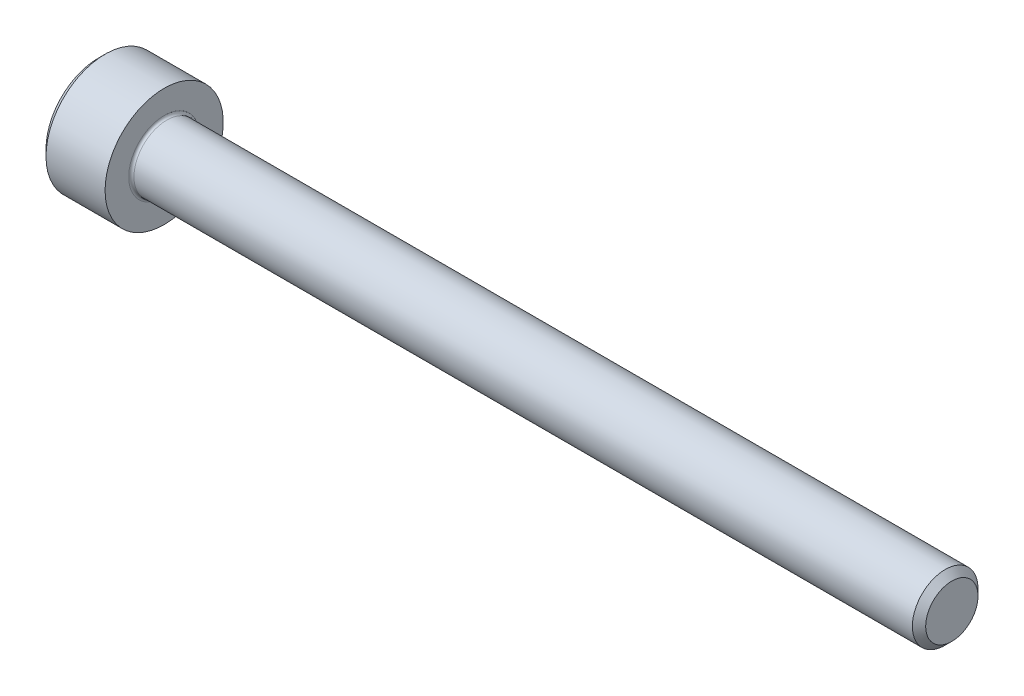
SolidWorks part; units mm, degrees
ref_plane "Plane1" through (0, 0, 0) normal (0, 0, 1) x (1, 0, 0)
ref_plane "Plane2" through (0, 0, 0) normal (0, 1, 0) x (1, 0, 0)
ref_plane "Plane3" through (0, 0, 0) normal (1, 0, 0) x (0, 0, -1)
sketch "BodySke" plane through (0, 0, 0) normal (0, 0, 1) x (1, 0, 0)
  line L0 (0, 0) -> (0, 2)
  line L1 (0.25, 2.25) -> (2.5, 2.25)
  line L2 (2.5, 2.25) -> (2.5, 1.25)
  line L3 (2.5, 1.25) -> (32.2465, 1.25)
  line L4 (32.5, 0.9965) -> (32.5, 0)
  line L5 (32.5, 0) -> (0, 0)
  line L6 (-31.75, 0) -> (127, 0) construction
  line L7 (0, 2) -> (0.25, 2.25)
  line L8 (32.5, 0.9965) -> (32.2465, 1.25)
  line L9 (0, -2) -> (0.25, -2.25) construction
  line L10 (32.5, -0.9965) -> (32.2465, -1.25) construction
  line L11 (2.95, 9.525) -> (2.95, 3.175) construction
  line L12 (15.5, 9.525) -> (15.5, 3.175) construction
  line L13 (-17.5, 9.525) -> (-17.5, 3.175) construction
  dimension "Diameter" = 2.5
  dimension "Head_ht" = 2.5
  dimension "Length" = 30
  dimension "Body_ch_ang" = 45
  dimension "Head_dia" = 4.5
  dimension "Head_ch_ang" = 45
  dimension "Minor_dia" = 1.993
  dimension "Advance" = 0.45
  dimension "Thread_nom" = 17
  dimension "Thread_length" = 50
  dimension "Head_ch_ht" = 0.25
revolve "Base-Revolve" add sketch "BodySke"
fillet "Fillet1" radius 0.1 1 edges at (2.5, 0, 1.25)
sketch "Sketch2" plane through (0, 0, 0) normal (0, 0, 1) x (1, 0, 0)
  line L0 (0, 1.0225) -> (1.1, 1.0225)
  line L1 (1.1, 1.0225) -> (1.6903, 0)
  line L2 (-31.75, 0) -> (127, 0) construction
  line L3 (1.6903, 0) -> (0, 0)
  line L4 (0, 0) -> (0, 1.0225)
  line L5 (0, 2) -> (0, -2) construction
  line L6 (0, 0) -> (47.625, 0) construction
  line L7 (2.5, -2.25) -> (2.5, 2.25) construction
  dimension "D1" = 1.0225
  dimension "D2" = 60
  dimension "Wall_thickness" = 1.4
revolve "Hex-PreBroach" cut sketch "Sketch2" angle 360 about L6
sketch "Sketch3" plane through (0, 0, 0) normal (-1, 0, 0) x (0, 0.5, 0.866)
  line L0 (0.5903, 1.0225) -> (-0.5903, 1.0225)
  line L1 (-0.5903, 1.0225) -> (-1.1807, 0)
  line L2 (0.5903, 1.0225) -> (1.1807, 0)
  line L3 (0.5903, -1.0225) -> (1.1807, 0)
  line L4 (0.5903, -1.0225) -> (-0.5903, -1.0225)
  line L5 (-0.5903, -1.0225) -> (-1.1807, 0)
  dimension "D1" = 1.0225
  dimension "D2" = 1.0225
  dimension "Hex_size" = 2.045
extrude "Hex" cut sketch "Sketch3" against normal blind 1.1
sketch "Sketch4" plane through (0, 0, 0) normal (-1, 0, 0) x (0, 0, 1)
  line L0 (0, 0) -> (1.2446, 0)
  line L1 (0, 0) -> (6.1484, 3.5498) construction
  line L2 (0, 0) -> (0.6223, 1.0779)
  line L3 (1.0085, 0.2596) -> (1.19, 0.3644)
  line L4 (0.7291, 0.7436) -> (0.9106, 0.8484)
  arc A0 (1.0085, 0.2596) -> (0.7291, 0.7436) centre (0, 0) ccw
  arc A1 (1.2446, 0) -> (1.19, 0.3644) centre (0, 0) ccw
  arc A2 (0.6223, 1.0779) -> (0.9106, 0.8484) centre (0, 0) cw
  dimension "D1" = 30
  dimension "Spline_n_dim" = 2.0828
  dimension "Spline_m_dim" = 2.4892
  dimension "D2" = 60
  dimension "D3" = 0.2794
  dimension "Spline_p_dim" = 0.5588
extrude "Spline" [suppressed] cut sketch "Sketch4" against normal blind 1.1
pattern_circular "CirPattern1" [suppressed] count 6 every 60
sketch "Sketch5" plane through (0, 0, 0) normal (0, 0, 1) x (1, 0, 0)
  line L0 (-31.75, 0) -> (127, 0) construction
  line L2 (0, 2) -> (0, -2) construction
  circle A0 centre (0.1, 0) radius 0.005
  dimension "Drilled_hole_dia" = 0.01
  dimension "Drilled_hole_loc" = 0.1
extrude "Hole" [suppressed] cut sketch "Sketch5" against normal through all and the other way through all
pattern_circular "Drilled-4" [suppressed] count 2 every 60
pattern_circular "Drilled-6" [suppressed] count 3 every 60
sketch "ThdSchSke" plane through (0, 0, 0) normal (0, 0, 1) x (1, 0, 0)
  line L0 (15.5, -0.9965) -> (15.3225, -1.25)
  line L1 (15.5, -0.9965) -> (15.6775, -1.25)
  line L2 (15.6775, -1.25) -> (15.6775, -1.5625)
  line L3 (-3.175, 0) -> (5.1513, 0) construction
  line L5 (15.6775, -1.5625) -> (15.3225, -1.5625)
  line L6 (15.3225, -1.5625) -> (15.3225, -1.25)
  line L7 (0, 2) -> (0, -2) construction
  dimension "Thread_minor" = 1.993
  dimension "Diameter" = 2.5
  dimension "Start" = 15.5
  dimension "SideAngle" = 55
  dimension "VeeAngle" = 70
  dimension "Overcut" = 3.125
revolve "ThreadSchematic" [suppressed] cut sketch "ThdSchSke" angle 360 about L3
pattern_linear "ThdSchPat" [suppressed]
equation "\"D2@Sketch3\" = \"Hex_size@Sketch3\" / 2"
equation "\"D1@Sketch3\" = \"Hex_size@Sketch3\" / 2"
equation "\"D1@Sketch2\" = \"Hex_size@Sketch3\" / 2"
equation "\"D3@Sketch4\" = \"Spline_p_dim@Sketch4\" / 2"
equation "\"Thread_minor@ThreadCosmetic\"  =  \"Minor_dia@BodySke\""
equation "\"D2@CirPattern1\" = 360 / \"Num_teeth@CirPattern1\""
equation "\"Wall_thickness@Sketch2\" = \"Head_ht@BodySke\" - \"Key_eng@Hex\""
equation "\"Thread_length@ThreadCosmetic\" = ((sgn( (\"Length@BodySke\" - \"Advance@BodySke\" ) - \"Thread_nom@BodySke\" )-1)*( (\"Length@BodySke\" - \"Advance@BodySke\" ) - \"Thread_nom@BodySke\" ))/-2+ \"Thread_nom@BodySke\""
equation "\"Thread_minor@ThdSchSke\" = \"Minor_dia@BodySke\""
equation "\"Diameter@ThdSchSke\" = \"Diameter@BodySke\""
equation "\"Overcut@ThdSchSke\" = \"Diameter@BodySke\" * 1.25"
equation "\"Start@ThdSchSke\" = \"Head_ht@BodySke\" + \"Length@BodySke\" - \"Thread_length@ThreadCosmetic\"  '---Non-countersunk---"
equation "\"Num_threads@ThdSchPat\" = int( \"Thread_length@ThreadCosmetic\" / \"Advance@BodySke\" + 0.999 )  + 1"
equation "\"Advance@ThdSchPat\" = \"Thread_length@ThreadCosmetic\" /  (\"Num_threads@ThdSchPat\" - 1) 'relax it"
equation "\"Num_threads@ThdSchPat\" = \"Num_threads@ThdSchPat\" - sgn( \"Num_threads@ThdSchPat\" - 1) '---chamfered tips only---"
